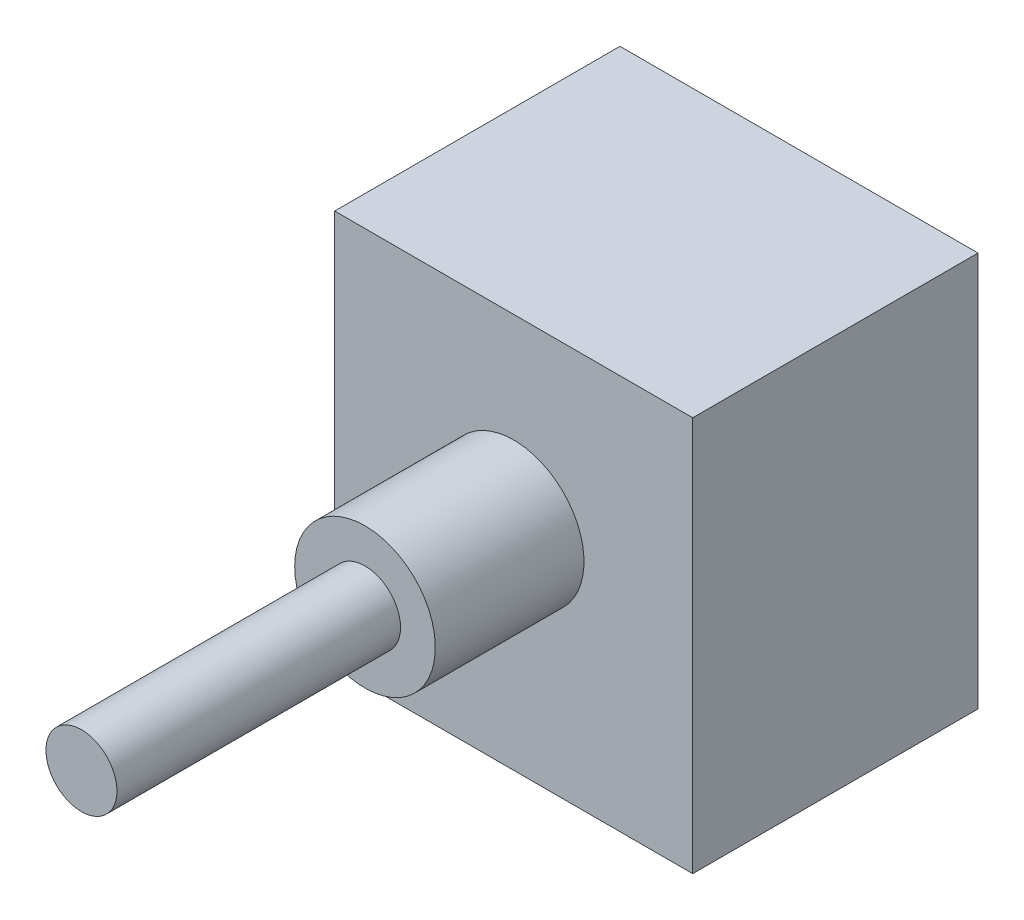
SolidWorks part; units mm, degrees
ref_plane "Front Plane" through (0, 0, 0) normal (0, 0, 1) x (1, 0, 0)
ref_plane "Top Plane" through (0, 0, 0) normal (0, 1, 0) x (1, 0, 0)
ref_plane "Right Plane" through (0, 0, 0) normal (1, 0, 0) x (0, 0, -1)
sketch "Sketch1" plane through (0, 0, 0) normal (0, 0, 1) x (1, 0, 0)
  line L0 (7.9058, 8.7186) -> (-7.9057, -8.7186) construction
  line L1 (-7.9057, -8.7186) -> (7.9058, -8.7186)
  line L2 (-7.9057, -8.7186) -> (-7.9057, 8.7186)
  line L3 (-7.9057, 8.7186) -> (7.9058, 8.7186)
  line L4 (7.9058, -8.7186) -> (7.9058, 8.7186)
  point P4 (0, 0)
  dimension "D1" = 15.8115
  dimension "D2" = 17.4371
extrude "Boss-Extrude1" add sketch "Sketch1" along normal blind 12.5984
sketch "Sketch2" plane through (0, 0, 12.5984) normal (0, 0, 1) x (1, 0, 0)
  line L0 (7.9058, -8.7186) -> (7.9058, 8.7186) construction
  line L1 (-7.9057, 8.7186) -> (7.9058, 8.7186) construction
  line L2 (-7.9057, 8.7186) -> (-7.9057, -7.093) construction
  line L3 (-7.9057, -7.093) -> (7.9058, -7.093) construction
  line L4 (7.9058, 8.7186) -> (7.9058, -7.093) construction
  line L5 (7.9058, -7.093) -> (-7.9057, 8.7186) construction
  circle A0 centre (0, 0.8128) radius 3.1051
  point P9 (0, 0.8128)
  dimension "D1" = 6.2103
extrude "Boss-Extrude2" add sketch "Sketch2" along normal blind 6.5659
sketch "Sketch3" plane through (0, 0, 19.1643) normal (0, 0, 1) x (1, 0, 0)
  circle A0 centre (0, 0.8128) radius 1.5684
  circle A1 centre (0, 0.8128) radius 3.1051 construction
  dimension "D1" = 3.1369
extrude "Boss-Extrude3" add sketch "Sketch3" along normal blind 12.5222
sketch "Sketch4" plane through (0, 0, 0) normal (0, 0, -1) x (-1, 0, 0)
  circle A0 centre (0, -7.62) radius 0.4445
  circle A1 centre (2.54, -7.62) radius 0.4445
  circle A2 centre (-2.54, -7.62) radius 0.4445
  dimension "D3" = 0.889
  dimension "D1" = 2.54
  dimension "D2" = 2.54
  dimension "D4" = 7.62
extrude "Boss-Extrude4" add sketch "Sketch4" along normal blind 1.016
